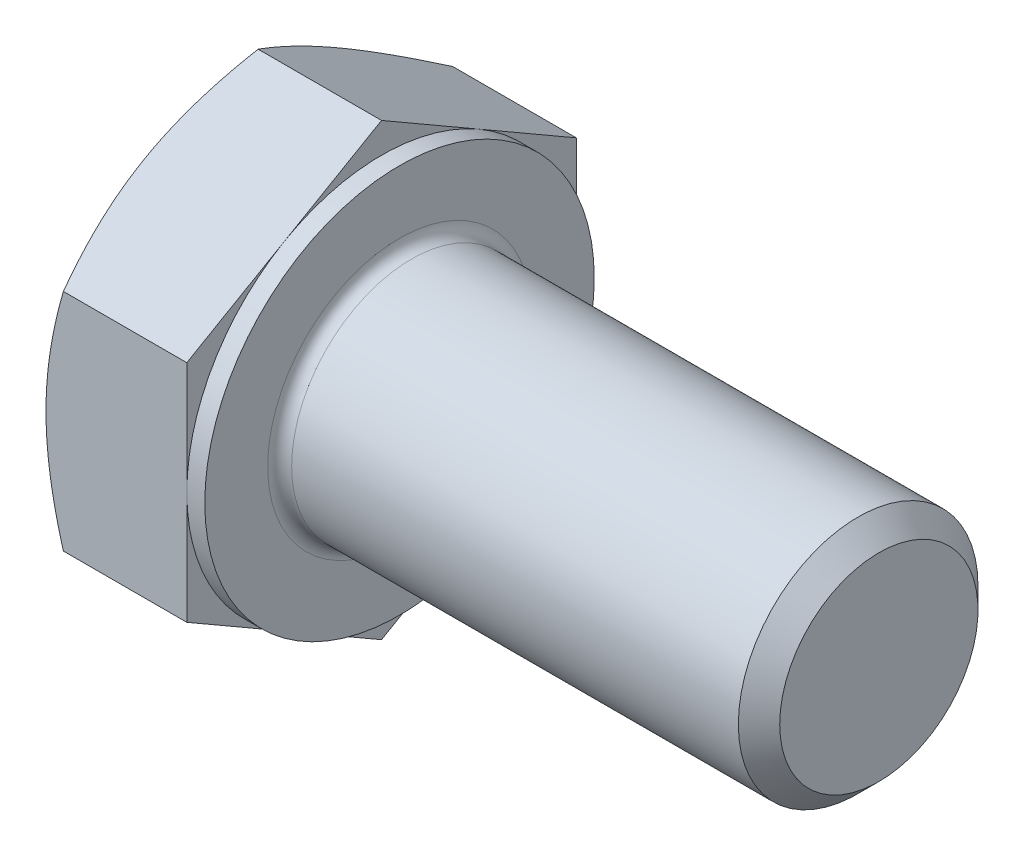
SolidWorks part; units mm, degrees
extrude "BaseHead" add sketch "Sketch1" along normal blind 5.3
sketch "Sketch1" plane through (0, 0, 0) normal (1, 0, 0) x (0, 0, -1)
  line L0 (6.5, 3.7528) -> (6.5, -3.7528)
  line L1 (-6.5, 3.7528) -> (-6.5, -3.7528)
  line L2 (6.5, -3.7528) -> (0, -7.5056)
  line L3 (0, -7.5056) -> (-6.5, -3.7528)
  line L4 (6.5, 3.7528) -> (0, 7.5056)
  line L5 (0, 7.5056) -> (-6.5, 3.7528)
revolve "HeadChamfer" cut sketch "Sketch3" angle 360 about L6
sketch "Sketch3" plane through (0, 0, 0) normal (0, 0, 1) x (1, 0, 0)
  line L0 (0, 6.5) -> (3.4673, 12.5056)
  line L1 (0, 7.5056) -> (0, 3.7528) construction
  line L2 (3.4673, 12.5056) -> (3.4673, 17.5056)
  line L3 (3.4673, 17.5056) -> (-10, 17.5056)
  line L4 (-10, 17.5056) -> (-10, 6.5)
  line L5 (-10, 6.5) -> (0, 6.5)
  line L6 (0, 0) -> (99.06, 0) construction
  line L7 (5.3, 7.5056) -> (0, 7.5056) construction
ref_plane "Plane1" through (0, 0, 0) normal (0, 0, 1) x (1, 0, 0)
ref_plane "Plane2" through (0, 0, 0) normal (0, 1, 0) x (1, 0, 0)
ref_plane "Plane3" through (0, 0, 0) normal (1, 0, 0) x (0, 0, -1)
other "Configuration Table"
sketch "BodySke" plane through (0, 0, 0) normal (0, 0, 1) x (1, 0, 0)
  line L0 (0, 3.7528) -> (0, -3.7528) construction
  line L1 (0, 0) -> (21.3, 0)
  line L2 (0, 0) -> (0, 4)
  line L3 (0, 4) -> (20.6095, 4)
  line L4 (21.3, 0) -> (21.3, 3.3095)
  line L5 (5.3, 7.5056) -> (5.3, 3.7528) construction
  line L6 (21.3, 3.3095) -> (20.6095, 4)
  line L7 (0, 0) -> (96.52, 0) construction
  line L8 (21.3, -3.3095) -> (20.6095, -4) construction
  line L9 (0, -4) -> (20.6095, -4) construction
  line L10 (6.55, 15.24) -> (6.55, -1.27) construction
  line L12 (5.3, 3.7528) -> (5.3, -3.7528) construction
revolve "BaseBody" add sketch "BodySke"
fillet "HeadFillet" radius 0.4 1 edges at (5.3, 0, -4)
sketch "Sketch4" plane through (0, 0, 0) normal (0, 0, 1) x (1, 0, 0)
  line L1 (5.3, 7.5056) -> (5.3, 3.7528) construction
  line L2 (5.3, 6.5) -> (4.7, 6.5)
  line L3 (5.3, 6.5) -> (5.3, 17.5056)
  line L4 (5.3, 17.5056) -> (4.7, 17.5056)
  line L5 (0, 0) -> (95.25, 0) construction
  line L6 (0, 0) -> (96.52, 0) construction
  line L7 (4.7, 6.5) -> (4.7, 17.5056)
  line L8 (5.3, 7.5056) -> (0.5806, 7.5056) construction
revolve "BearingFace" cut sketch "Sketch4" angle 360 about L5
sketch "ThdSchSke" plane through (0, 0, 0) normal (0, 0, 1) x (1, 0, 0)
  line L0 (6.55, -3.3095) -> (6.0665, -4)
  line L1 (6.55, -3.3095) -> (7.0335, -4)
  line L2 (7.0335, -4) -> (7.0335, -5)
  line L3 (-3.175, 0) -> (5.1513, 0) construction
  line L5 (7.0335, -5) -> (6.0665, -5)
  line L6 (6.0665, -5) -> (6.0665, -4)
revolve "ThreadSchematic" [suppressed] cut sketch "ThdSchSke" angle 360 about L3
pattern_linear "ThdSchPat" [suppressed]
equation "\"D3@Sketch1\" = \"Width_flats@Sketch1\" / 2"
equation "\"D4@Sketch1\" = \"D3@Sketch1\""
equation "\"D5@Sketch1\" = \"D4@Sketch1\""
equation "\"Thread_minor@ThreadCosmetic\" = \"Minor_dia@BodySke\""
equation "\"D1@Sketch3\" = \"Width_flats@Sketch1\" / 2"
equation "\"D1@Sketch4\" = \"Width_flats@Sketch1\""
equation "\"Thread_length@ThreadCosmetic\" = \"Length@BodySke\" - \"Advance@BodySke\""
equation "\"Thread_minor@ThdSchSke\" = \"Minor_dia@BodySke\""
equation "\"Diameter@ThdSchSke\" = \"Diameter@BodySke\""
equation "\"Overcut@ThdSchSke\" = \"Diameter@BodySke\" * 1.25"
equation "\"Start@ThdSchSke\" = \"Head_ht@BaseHead\" + \"Length@BodySke\" - \"Thread_length@ThreadCosmetic\"  '---Non-countersunk---"
equation "\"Num_threads@ThdSchPat\" = int( \"Thread_length@ThreadCosmetic\" / \"Advance@BodySke\" + 0.999 )  + 1"
equation "\"Advance@ThdSchPat\" = \"Thread_length@ThreadCosmetic\" /  (\"Num_threads@ThdSchPat\" - 1) 'relax it"
equation "\"Num_threads@ThdSchPat\" = \"Num_threads@ThdSchPat\" - sgn( \"Num_threads@ThdSchPat\" - 1) '---chamfered tips only---"
